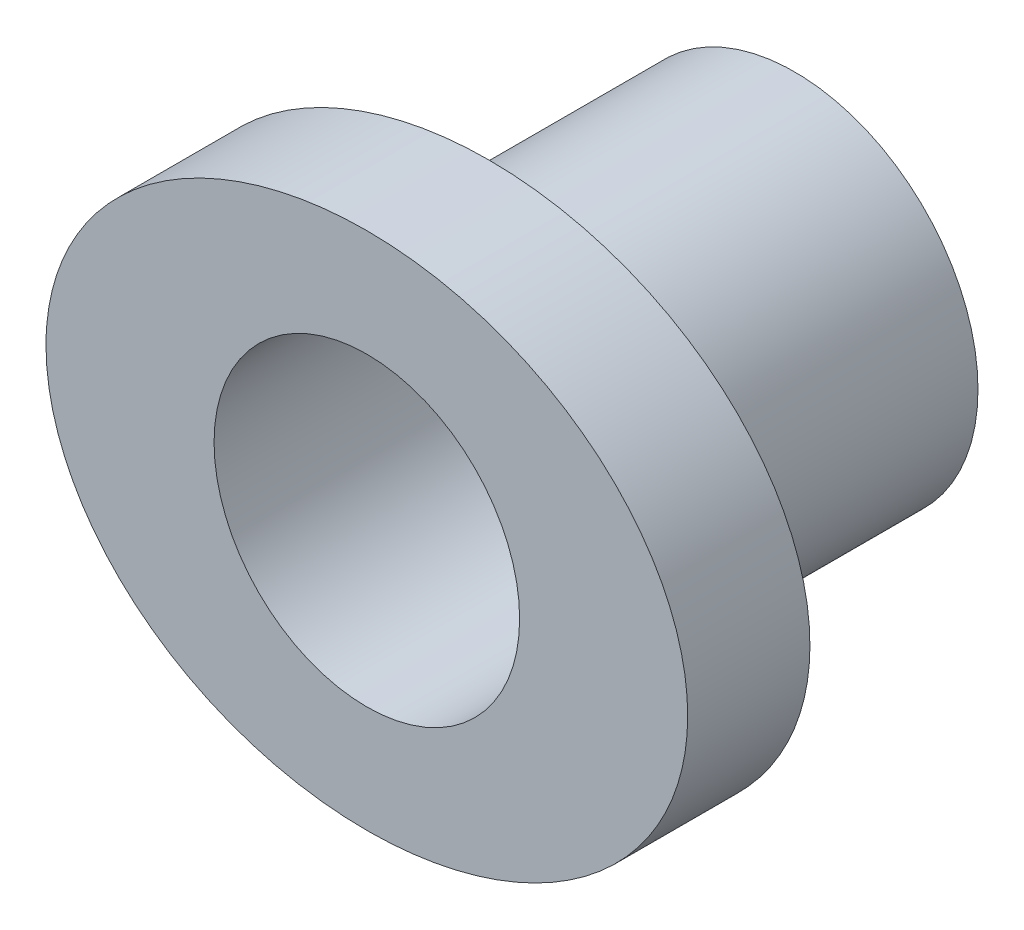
SolidWorks part; units mm, degrees
ref_plane "Front Plane" through (0, 0, 0) normal (0, 0, 1) x (1, 0, 0)
ref_plane "Top Plane" through (0, 0, 0) normal (0, 1, 0) x (1, 0, 0)
ref_plane "Right Plane" through (0, 0, 0) normal (1, 0, 0) x (0, 0, -1)
sketch "Sketch1" plane through (0, 0, 0) normal (0, 0, 1) x (1, 0, 0)
  line L0 (0, 4.25) -> (0, -4.25) construction
  circle A1 centre (0, 0) radius 2.5
  ellipse E0 centre (0, 0) end of major axis (-5.25, 0) minor radius 4.25
  dimension "D3" = 5
  dimension "D1" = 4.25
  dimension "D2" = 5.25
extrude "Boss-Extrude1" add sketch "Sketch1" along normal blind 2
sketch "Sketch2" plane through (0, 0, 0) normal (0, 0, -1) x (-1, 0, 0)
  circle A1 centre (0, 0) radius 2.5
  circle A2 centre (0, 0) radius 2.5 construction
  circle A3 centre (0, 0) radius 3
  dimension "D1" = 0.5
extrude "Boss-Extrude2" add sketch "Sketch2" along normal blind 5
